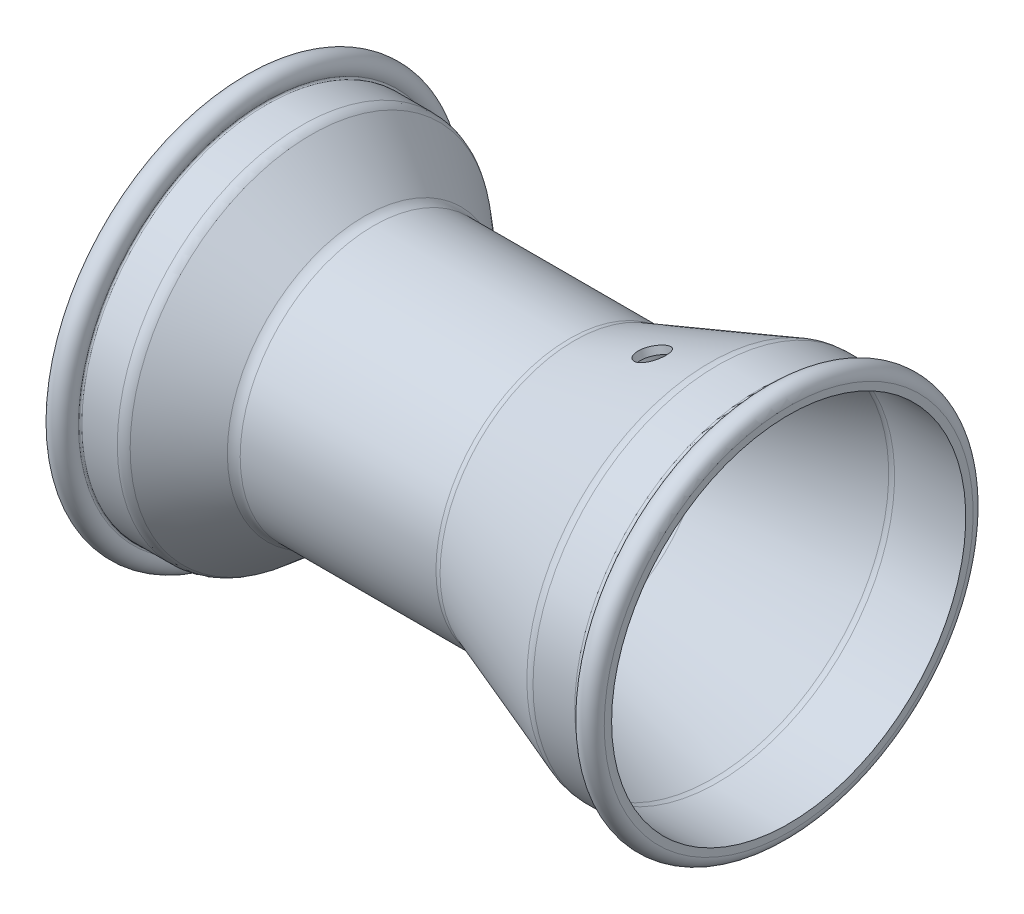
SolidWorks part; units mm, degrees
ref_plane "Plan1" through (0, 0, 0) normal (0, 0, 1) x (1, 0, 0)
ref_plane "Plan2" through (0, 0, 0) normal (0, 1, 0) x (1, 0, 0)
ref_plane "Plan3" through (0, 0, 0) normal (1, 0, 0) x (0, 0, -1)
sketch "Esquisse1" plane through (0, 0, 0) normal (0, 0, 1) x (1, 0, 0)
  line L0 (-112, 0) -> (127, 0) construction
  line L1 (-141.5552, 65) -> (-141.5552, 61)
  line L2 (-133.5552, 62.5) -> (-121.5552, 62.5)
  line L3 (-118.3543, 61.3412) -> (-100.3934, 46.3742)
  line L4 (43.4448, 61) -> (43.4448, 60)
  line L5 (33.4448, 62.5) -> (19.3176, 62.5)
  line L6 (-28.3234, 43.1589) -> (17.6236, 59.7043)
  line L7 (-76.5552, 40.7154) -> (-76.5552, 20)
  line L8 (-137.7443, 60) -> (-121.5552, 60)
  line L9 (-119.9548, 59.4206) -> (-101.9938, 44.4536)
  line L10 (-76.5552, 20) -> (-69.5552, 20)
  line L11 (-69.5552, 20) -> (-69.5552, 40.7154)
  line L12 (-97.1925, 45.2154) -> (-30.8644, 45.2154)
  line L13 (-97.1925, 42.7154) -> (-78.5552, 42.7154)
  line L14 (-67.5552, 42.7154) -> (-30.8644, 42.7154)
  line L15 (-29.1704, 45.5111) -> (16.7766, 62.0564)
  line L17 (43.4448, 62.5) -> (43.4448, 61)
  line L18 (35.5067, 60) -> (19.3176, 60)
  line L19 (43.4448, 60) -> (35.5067, 60)
  line L20 (-141.5552, 61) -> (-141.5552, 60)
  line L21 (-141.5552, 60) -> (-137.7443, 60)
  arc A0 (-29.1704, 45.5111) -> (-30.8644, 45.2154) centre (-30.8644, 50.2154) cw
  arc A1 (-97.1925, 45.2154) -> (-100.3934, 46.3742) centre (-97.1925, 50.2154) cw
  arc A2 (-118.3543, 61.3412) -> (-121.5552, 62.5) centre (-121.5552, 57.5) ccw
  arc A3 (-28.3234, 43.1589) -> (-30.8644, 42.7154) centre (-30.8644, 50.2154) cw
  arc A4 (-97.1925, 42.7154) -> (-101.9938, 44.4536) centre (-97.1925, 50.2154) cw
  arc A5 (-119.9548, 59.4206) -> (-121.5552, 60) centre (-121.5552, 57.5) ccw
  arc A6 (17.6236, 59.7043) -> (19.3176, 60) centre (19.3176, 55) cw
  arc A7 (-141.5552, 65) -> (-133.9844, 63.1974) centre (-137.5552, 65) cw
  arc A8 (43.4448, 62.5) -> (35.7525, 64.0385) centre (39.4448, 62.5) ccw
  arc A9 (35.7525, 64.0385) -> (33.4448, 62.5) centre (33.4448, 65) cw
  arc A10 (-133.9844, 63.1974) -> (-133.5552, 62.5) centre (-133.5552, 62.9808) ccw
  arc A11 (19.3176, 62.5) -> (16.7766, 62.0564) centre (19.3176, 55) ccw
  arc A13 (-76.5552, 40.7154) -> (-78.5552, 42.7154) centre (-78.5552, 40.7154) ccw
  arc A14 (-69.5552, 40.7154) -> (-67.5552, 42.7154) centre (-67.5552, 40.7154) cw
  point P25 (-101.5552, 45)
  point P30 (-29.5552, 42.7154)
  point P50 (-76.5552, 42.7154)
  point P53 (18.4448, 60)
  dimension "D13" = 40
  dimension "D15" = 5
  dimension "D16" = 7.5
  dimension "D12" = 20
  dimension "D14" = 2.5
  dimension "D17" = 5
  dimension "D18" = 7.5
  dimension "D5" = 4
  dimension "D8" = 7.5
  dimension "D1" = 185
  dimension "D2" = 2.5
  dimension "D3" = 65
  dimension "D4" = 7
  dimension "D6" = 25
  dimension "D7" = 20
  dimension "D9" = 40
  dimension "D10" = 60
  dimension "D11" = 62.5
  dimension "D21" = 12
  dimension "D24" = 2.5
revolve "Base-Révolution" add sketch "Esquisse1" angle 360 about L0
ref_plane "Plan4" through (-6.1969, 53.7838, 0) normal (-0.3388, 0.9409, 0) x (0, 0, -1)
sketch "Esquisse2" plane through (-6.1969, 53.7838, 0) normal (-0.3388, 0.9409, 0) x (0, 0, -1)
  line L0 (0, 117.7677) -> (0, -107.0975) construction
  line L1 (0, 62.3915) -> (0, -37.6085) construction
  circle A0 centre (0, -3.5694) radius 5
  ellipse E4 centre (0, 41.4306) end of major axis (45.2154, 41.4306) minor radius 15.319 construction
  dimension "D1" = 10
  dimension "D2" = 45
extrude "Enlèv. mat.-Extru.1" cut sketch "Esquisse2" against normal up to next
sketch "Esquisse3" plane through (-76.5552, 0, 0) normal (-1, 0, 0) x (0, 0, 1)
  circle A0 centre (0, 30) radius 4.5
  dimension "D1" = 9
  dimension "D2" = 30
extrude "Enlèv. mat.-Extru.2" cut sketch "Esquisse3" against normal through all
pattern_circular "Répétition circulaire1" count 3 every 120 about axis through (-112, 0, 0) along (1, 0, 0)
